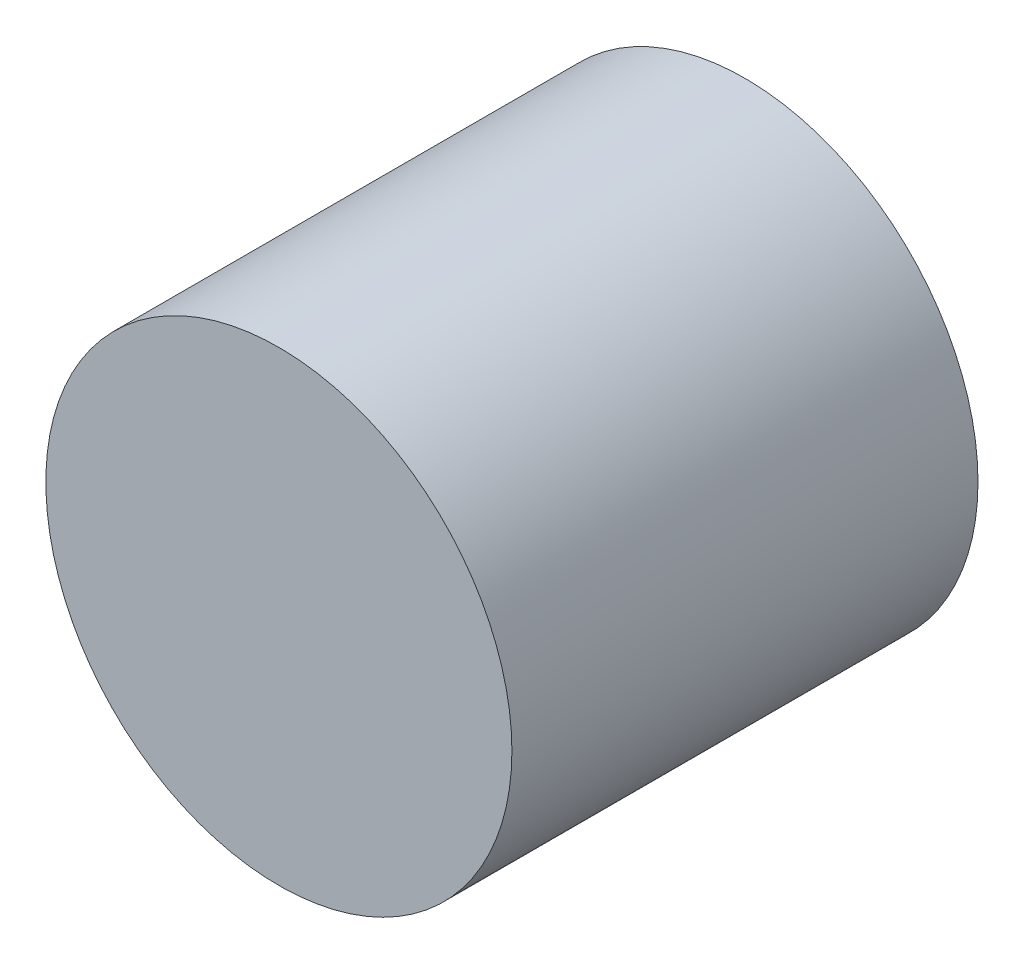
SolidWorks part; units mm, degrees
ref_plane "Front" through (0, 0, 0) normal (0, 0, 1) x (1, 0, 0)
ref_plane "Top" through (0, 0, 0) normal (0, 1, 0) x (1, 0, 0)
ref_plane "Right" through (0, 0, 0) normal (1, 0, 0) x (0, 0, -1)
ref_plane "Front-SubMaster1" through (0, 0, 0) normal (0, 0, 1) x (1, 0, 0)
ref_plane "Top-SubMaster1" through (0, 0, 0) normal (0, 1, 0) x (1, 0, 0)
ref_plane "Right-SubMaster1" through (0, 0, 0) normal (1, 0, 0) x (0, 0, -1)
ref_plane "Front-MasterPart-SubMaster1" through (0, 0, 0) normal (0, 0, 1) x (1, 0, 0)
ref_plane "Top-MasterPart-SubMaster1" through (0, 0, 0) normal (0, 1, 0) x (1, 0, 0)
ref_plane "Right-MasterPart-SubMaster1" through (0, 0, 0) normal (1, 0, 0) x (0, 0, -1)
sketch "Sketch2-SubMaster1" plane through (0, 0, 0) normal (0, 0, 1) x (1, 0, 0)
  circle A0 centre (-44.02, 33.7971) radius 25.4
inserted part "SubMaster1"
sketch "Sketch2" plane through (0, 0, 0) normal (0, 0, 1) x (1, 0, 0)
  circle A0 centre (-44.02, 33.7971) radius 25.4 construction
  circle A1 centre (-44.02, 33.7971) radius 25.4
extrude "Extrude1" add sketch "Sketch2" along normal blind 50.8
